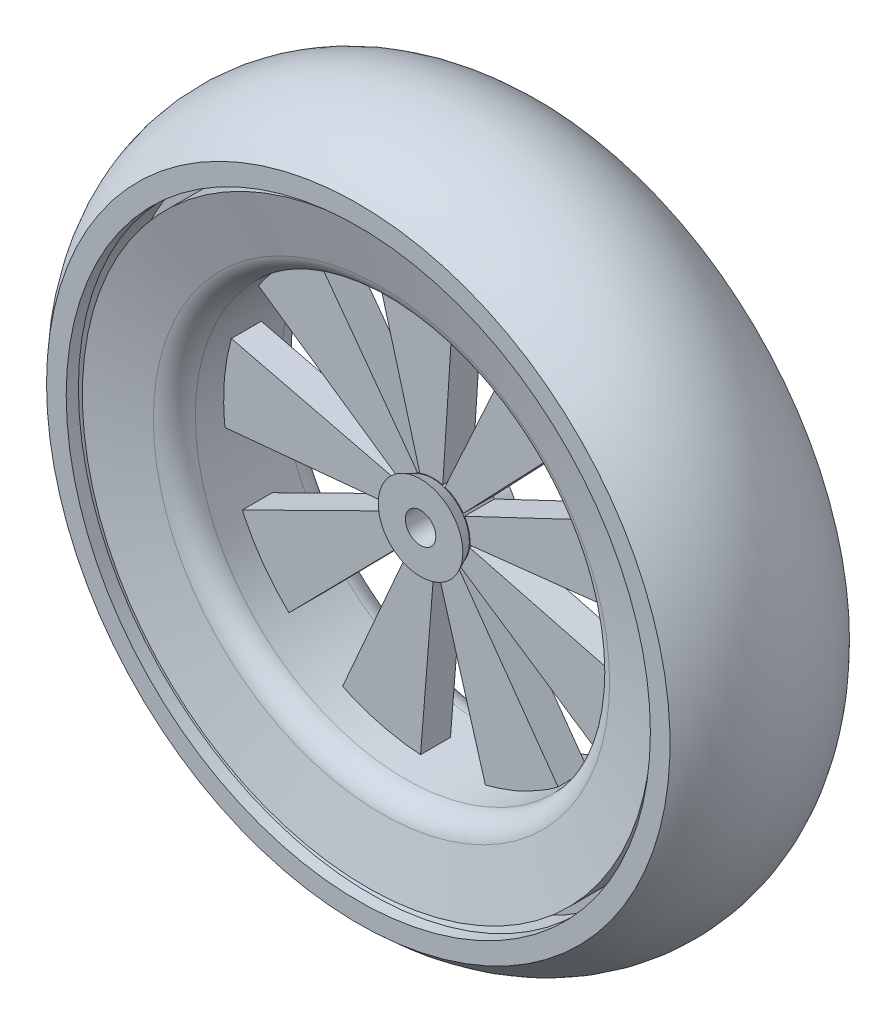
SolidWorks part; units mm, degrees
ref_plane "Front Plane" through (0, 0, 0) normal (0, 0, 1) x (1, 0, 0)
ref_plane "Top Plane" through (0, 0, 0) normal (0, 1, 0) x (1, 0, 0)
ref_plane "Right Plane" through (0, 0, 0) normal (1, 0, 0) x (0, 0, -1)
sketch "Sketch1" plane through (0, 0, 0) normal (0, 0, 1) x (1, 0, 0)
  circle A0 centre (0, 0) radius 30
  dimension "D1" = 60
extrude "Boss-Extrude1" add sketch "Sketch1" along normal blind 25
sketch "Sketch2" plane through (0, 0, 25) normal (0, 0, 1) x (1, 0, 0)
  circle A0 centre (0, 0) radius 30
extrude "Boss-Extrude2" add sketch "Sketch2" along normal blind 10 draft 25
sketch "Sketch3" plane through (0, 0, 0) normal (0, 0, -1) x (-1, 0, 0)
  circle A0 centre (0, 0) radius 30
extrude "Boss-Extrude3" add sketch "Sketch3" along normal blind 10 draft 25
sketch "Sketch4" plane through (0, 0, 35) normal (0, 0, 1) x (1, 0, 0)
  circle A0 centre (0, 0) radius 12.5
  dimension "D1" = 25
extrude "Cut-Extrude1" cut sketch "Sketch4" against normal blind 60
sketch "Sketch5" plane through (0, 0, 0) normal (1, 0, 0) x (0, 0, -1)
  line L0 (-35, 0) -> (10, 0) construction
  line L1 (30.3955, 181.9087) -> (-55.3955, 181.9087)
  line L2 (10, -34.6631) -> (10, 34.6631) construction
  line L3 (-35, 34.6631) -> (-35, -34.6631) construction
  line L4 (-12.5, 0) -> (-12.5, 347.7532) construction
  line L5 (-55.3955, 181.9087) -> (-66.0115, 223.2351)
  line L6 (-66.0115, 223.2351) -> (-26.0115, 223.2351)
  line L7 (-26.0115, 223.2351) -> (-26.0115, 255.4622)
  line L8 (-26.0115, 255.4622) -> (-86.0115, 255.4622)
  line L9 (-86.0115, 255.4622) -> (-86.0115, 239.3486)
  line L10 (61.0115, 255.4622) -> (61.0115, 239.3486)
  line L11 (1.0115, 255.4622) -> (61.0115, 255.4622)
  line L12 (1.0115, 223.2351) -> (1.0115, 255.4622)
  line L13 (41.0115, 223.2351) -> (1.0115, 223.2351)
  line L14 (30.3955, 181.9087) -> (41.0115, 223.2351)
  point P21 (-12.5, 181.9087)
  dimension "D1" = 40
  dimension "D2" = 60
revolve "Revolve-Thin3" add sketch "Sketch5" angle 360 about L0
sketch "Sketch6" plane through (0, 0, 0) normal (0, 0, 1) x (1, 0, 0)
  line L0 (-3.6014, 34.4755) -> (0, 34.6631)
  line L1 (0, 34.6631) -> (4.4606, 34.3749)
  line L2 (4.4606, 34.3749) -> (8.0254, 33.7212)
  line L3 (8.0254, 33.7212) -> (16.9, 171.0759)
  line L4 (16.9, 171.0759) -> (12.4627, 171.4563)
  line L5 (12.4627, 171.4563) -> (0, 171.9087)
  line L6 (0, 171.9087) -> (-10.7428, 171.5727)
  line L7 (-10.7428, 171.5727) -> (-17.5068, 171.0149)
  line L8 (-17.5068, 171.0149) -> (-34.6631, 168.3777)
  line L9 (-34.6631, 168.3777) -> (-42.6028, 166.546)
  line L10 (-42.6028, 166.546) -> (-48.8232, 164.8298)
  line L11 (-48.8232, 164.8298) -> (-12.2892, 32.4115)
  line L12 (-12.2892, 32.4115) -> (-10.7428, 32.9564)
  line L13 (-10.7428, 32.9564) -> (-6.0688, 34.1277)
  line L14 (-6.0688, 34.1277) -> (-3.6014, 34.4755)
  line L15 (-12.2892, 32.4115) -> (-11.0428, 27.8937)
  line L16 (-11.0428, 27.8937) -> (-8.8819, 28.6551)
  line L17 (-8.8819, 28.6551) -> (-7.068, 29.1555)
  line L18 (-7.068, 29.1555) -> (-6.0688, 29.3797)
  line L19 (-6.0688, 29.3797) -> (-3.6014, 29.783)
  line L20 (-3.6014, 29.783) -> (-1.5025, 29.9623)
  line L21 (-1.5025, 29.9623) -> (0, 30)
  line L22 (0, 30) -> (1.7909, 29.9465)
  line L23 (1.7909, 29.9465) -> (3.5988, 29.7834)
  line L24 (3.5988, 29.7834) -> (6.2416, 29.3435)
  line L25 (6.2416, 29.3435) -> (7.2947, 29.0996)
  line L27 (8.1072, 34.9876) -> (7.7268, 29.0996)
  line L28 (7.7268, 29.0996) -> (7.2947, 29.0996)
  circle A0 centre (0, 0) radius 34.6631 construction
  circle A1 centre (0, 0) radius 171.9087 construction
  circle A2 centre (0, 0) radius 30 construction
extrude "Boss-Extrude7" add sketch "Sketch6" along normal blind 24.5 contours L28 L27 L2 L1 L0 L14 L13 L12 L15 L16 L17 L18 L19 L20 L21 L22 L23 L24 L25 | L13 L14 L0 L1 L2 L3 L4 L5 L6 L7 L8 L9 L10 L11 L12
pattern_circular "CirPattern6" count 9 over 360 about axis through (0, 0, 0) along (0, 0, 1) of "Boss-Extrude7"
sketch "Sketch7" plane through (0, 0, 0) normal (0, 1, 0) x (1, 0, 0)
  line L0 (255.4622, 61.0115) -> (255.4622, -86.0115)
  line L1 (0, 61.0115) -> (0, -86.0115) construction
  line L2 (239.3486, 61.0115) -> (-239.3486, 61.0115) construction
  line L3 (-255.4622, -86.0115) -> (255.4622, -86.0115) construction
  arc A0 (255.4622, 61.0115) -> (255.4622, -86.0115) centre (181.9507, -12.5) cw
revolve "Revolve4" add sketch "Sketch7" angle 360 about L1
fillet "Fillet2" radius 20 2 edges at (171.9087, 0, 63.1513) (171.9087, 0, -38.1513)
sketch "Sketch8" plane through (0, 0, 0) normal (1, 0, 0) x (0, 0, -1)
scale "Scale3" bodies to scale 121 113 scale about origin uniform scaling yes scale factor 0.9
sketch "Sketch9" plane through (0, 0, 0) normal (0, 0, 1) x (1, 0, 0)
  circle A0 centre (0, 0) radius 11.25
